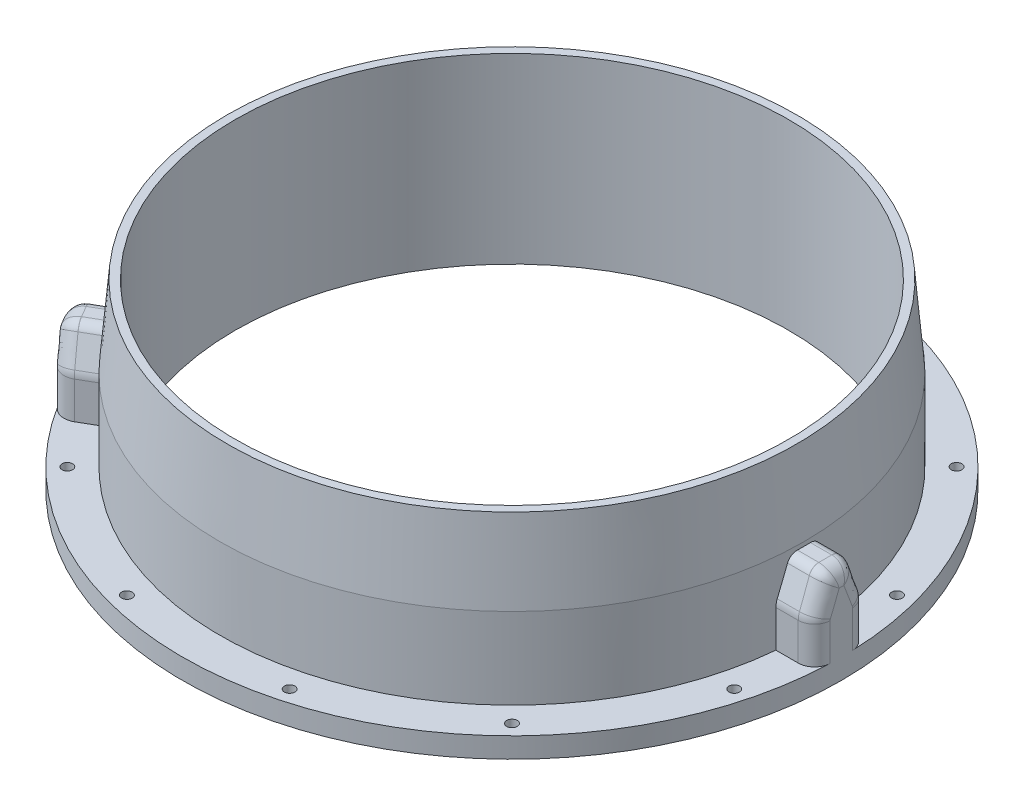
SolidWorks part; units mm, degrees
ref_plane "Front" through (0, 0, 0) normal (0, 0, 1) x (1, 0, 0)
ref_plane "Top" through (0, 0, 0) normal (0, 1, 0) x (1, 0, 0)
ref_plane "Right" through (0, 0, 0) normal (1, 0, 0) x (0, 0, -1)
sketch "Sketch1" plane through (0, 0, 0) normal (0, 0, 1) x (1, 0, 0)
  line L0 (0, 50.8) -> (89.2178, 50.8)
  line L1 (0, 0) -> (91.44, 0)
  line L2 (91.44, 25.4) -> (89.2178, 50.8)
  line L3 (0, 50.8) -> (0, 0)
  line L4 (91.44, 25.4) -> (91.44, 0)
  dimension "D1" = 5
  dimension "D2" = 25.4
  dimension "D3" = 50.8
  dimension "D4" = 91.44
revolve "Revolve1" add sketch "Sketch1" angle 360 about L3
sketch "Sketch2" plane through (0, 0, 0) normal (0, -1, 0) x (1, 0, 0)
  circle A0 centre (0, 0) radius 103.1875
  dimension "D1" = 206.375
extrude "Boss-Extrude1" add sketch "Sketch2" along normal blind 6.35
hole_wizard "Tap Drill for M4x0.7 Tap2" positions "Sketch5" profile "Sketch6" hole size "M4x0.7" standard "ANSI Metric"
sketch "Sketch5" plane through (0, -6.35, 0) normal (0, -1, 0) x (-1, 0, 0)
  line L0 (-25.4743, 95.0712) -> (0, 0)
  line L2 (0, 0) -> (0, 103.1875)
  line L3 (0, 0) -> (25.4743, 95.0712)
  circle A0 centre (0, 0) radius 103.1875 construction
  point P0 (-25.4743, 95.0712)
  point P24 (25.4743, 95.0712)
  dimension "D1" = 98.425
  dimension "D2" = 15
sketch "Sketch6" plane through (25.4743, -6.35, -95.0712) normal (1, 0, 0) x (0, 0, -1)
  line L0 (0, 0) -> (0, 57.15)
  line L1 (0, 57.15) -> (1.65, 57.15)
  line L2 (1.65, 57.15) -> (1.65, 0)
  line L5 (1.65, 0) -> (0, 0)
  line L11 (0, -6.35) -> (0, 107.95) construction
  dimension "Thru Hole Dia." = 3.3
  dimension "Thru Hole Depth" = 57.15
pattern_circular "CirPattern1" count 6 over 360 about axis through (0, 0, 0) along (0, 1, 0) of "Tap Drill for M4x0.7 Tap2"
sketch "Sketch8" plane through (0, 0, 0) normal (1, 0, 0) x (0, 0, -1)
  line L0 (-8.4137, 0) -> (-8.4137, 12.7)
  line L1 (103.1875, 0) -> (-103.1875, 0) construction
  line L2 (-8.4137, 12.7) -> (-5.0139, 22.0409)
  line L3 (5.0139, 22.0409) -> (8.4137, 12.7)
  line L4 (8.4137, 12.7) -> (8.4137, 0)
  line L5 (8.4137, 0) -> (-8.4137, 0)
  line L6 (-2.0304, 24.13) -> (2.0304, 24.13)
  line L7 (0, 25.4) -> (0, 50.8) construction
  arc A1 (-2.0304, 24.13) -> (-5.0139, 22.0409) centre (-2.0304, 20.955) ccw
  arc A2 (2.0304, 24.13) -> (5.0139, 22.0409) centre (2.0304, 20.955) cw
  point P10 (0, 0)
  point P13 (0, 24.13)
  dimension "D4" = 24.13
  dimension "D3" = 3.175
  dimension "D1" = 16.8275
  dimension "D2" = 20
  dimension "D5" = 12.7
extrude "Boss-Extrude2" add sketch "Sketch8" along normal up to surface (102.8439 mm away)
shell "Shell1" [suppressed] thickness 2.54
fillet "Fillet1" radius 5.08 7 edges at (103.1218, 23.6666, 3.682) (103.1094, 23.4342, -4.0139) (102.8439, 6.35, 8.4137) (102.8439, 6.35, -8.4137) (102.9688, 17.3679, 6.7148) (103.1875, 24.13, 0) (102.9688, 17.3679, -6.7148)
fillet "Fillet2" radius 6.35 4 edges at (94.546, 12.7, -8.4137) (101.1894, 12.4891, 7.3282) (94.546, 12.7, 8.4137)
fillet "Fillet3" [suppressed] radius 3.175
pattern_circular "CirPattern2" count 12 over 360 about axis through (0, 50.8, 0) along (0, 1, 0) of "Boss-Extrude2", "Fillet1", "Fillet2"
sketch "Sketch7" plane through (0, 50.8, 0) normal (0, 1, 0) x (1, 0, 0)
  circle A0 centre (0, 0) radius 86.6778
  circle A1 centre (0, 0) radius 89.2178 construction
  dimension "D1" = 2.54
extrude "Cut-Extrude1" cut sketch "Sketch7" against normal through all
sketch "Sketch10" plane through (0, 0, 0) normal (0, 0, 1) x (1, 0, 0)
  line L0 (86.6778, 50.8) -> (89.2178, 50.8)
  line L1 (89.2178, 50.8) -> (-89.2178, 50.8) construction
  line L2 (89.2178, 50.8) -> (89.0233, 53.0225)
  line L3 (89.0233, 53.0225) -> (83.9433, 53.0225)
  line L4 (83.9433, 53.0225) -> (83.9433, 51.435)
  line L5 (83.9433, 51.435) -> (86.6778, 51.435)
  line L6 (86.6778, 51.435) -> (86.6778, 50.8)
  line L10 (89.2178, 50.8) -> (91.44, 25.4) construction
  line L13 (0, 0) -> (0, 61.0355) construction
  dimension "D1" = 0.635
  dimension "D2" = 5.08
  dimension "D3" = 1.5875
revolve "Revolve2" [suppressed] add sketch "Sketch10" angle 360 about L13
fillet "Fillet4" [suppressed] radius 1.27
fillet "Fillet5" [suppressed] radius 0.635
